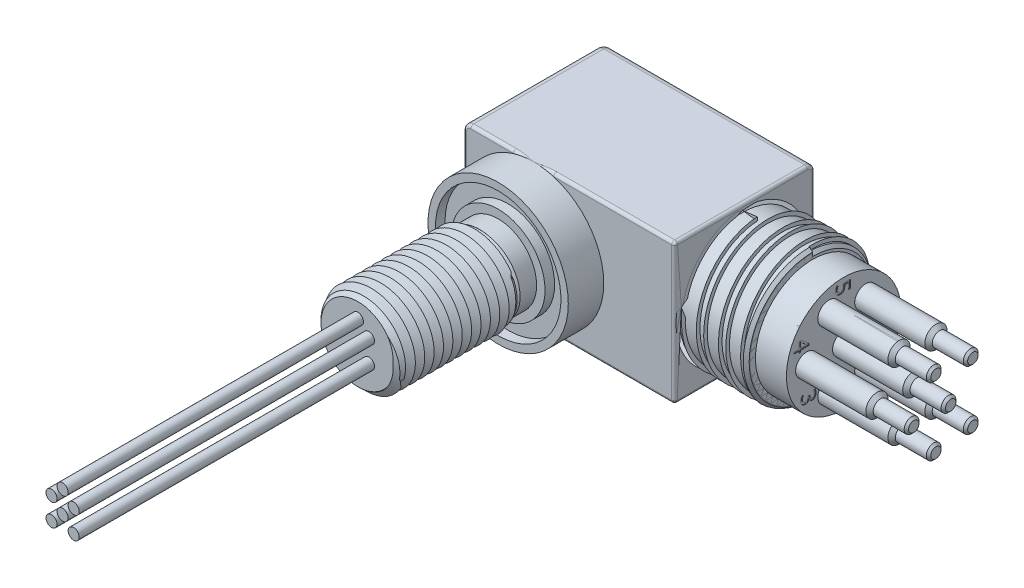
SolidWorks part; units mm, degrees
ref_plane "Front Plane" through (0, 0, 0) normal (0, 0, 1) x (1, 0, 0)
ref_plane "Top Plane" through (0, 0, 0) normal (0, 1, 0) x (1, 0, 0)
ref_plane "Right Plane" through (0, 0, 0) normal (1, 0, 0) x (0, 0, -1)
imported_body "Surface-Imported2"
imported_body "Surface-Imported3"
sketch "Sketch1" plane through (19.1, 0, 0) normal (1, 0, 0) x (0, 0, -1)
  circle A0 centre (9.2, 0) radius 8.5
  circle A1 centre (9.2, 0) radius 7.75 construction
  arc A2 (2.8833, -5.6876) -> (9.2, 8.5) centre (9.2, 0) ccw construction
extrude "Boss-Extrude1" add sketch "Sketch1" along normal up to surface (9.1 mm away)
